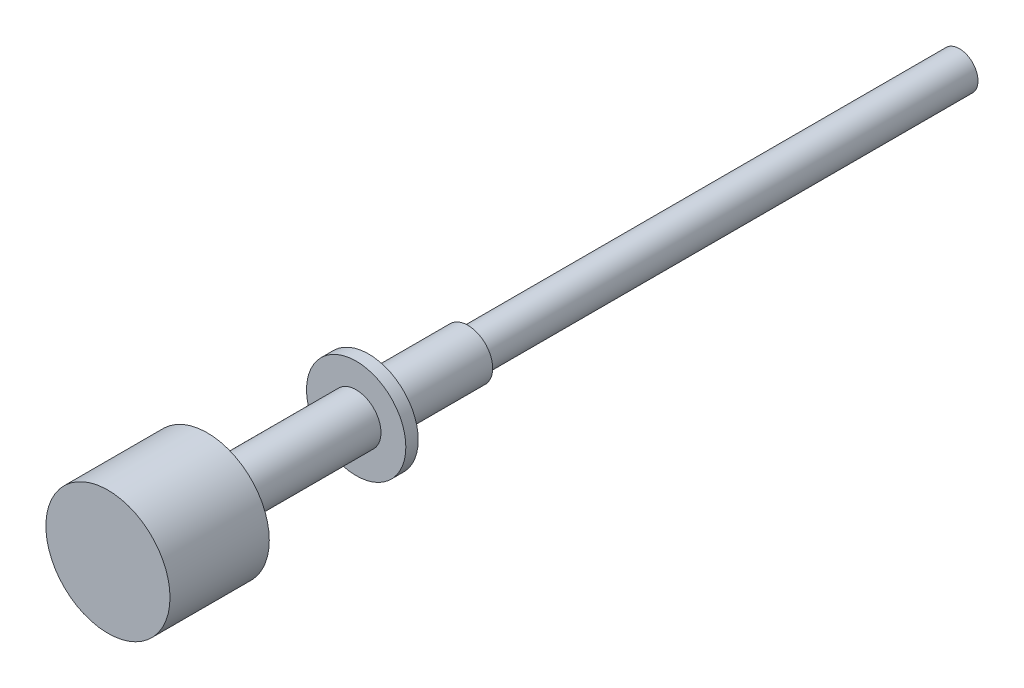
SolidWorks part; units mm, degrees
ref_plane "Front Plane" through (0, 0, 0) normal (0, 0, 1) x (1, 0, 0)
ref_plane "Top Plane" through (0, 0, 0) normal (0, 1, 0) x (1, 0, 0)
ref_plane "Right Plane" through (0, 0, 0) normal (1, 0, 0) x (0, 0, -1)
sketch "Sketch2" plane through (0, 0, 0) normal (0, 0, 1) x (1, 0, 0)
  circle A0 centre (0, 0) radius 4.7625
extrude "Boss-Extrude2" add sketch "Sketch2" along normal blind 125.73
sketch "Sketch3" plane through (0, 0, 125.73) normal (0, 0, 1) x (1, 0, 0)
  circle A0 centre (0, 0) radius 6.35
extrude "Boss-Extrude3" add sketch "Sketch3" along normal blind 25.4
sketch "Sketch4" plane through (0, 0, 151.13) normal (0, 0, 1) x (1, 0, 0)
  circle A0 centre (0, 0) radius 12.7
extrude "Boss-Extrude4" add sketch "Sketch4" along normal blind 3.175
sketch "Sketch5" plane through (0, 0, 154.305) normal (0, 0, 1) x (1, 0, 0)
  circle A0 centre (0, 0) radius 6.35
extrude "Boss-Extrude5" add sketch "Sketch5" along normal blind 38.1
sketch "Sketch6" plane through (0, 0, 192.405) normal (0, 0, 1) x (1, 0, 0)
  circle A0 centre (0, 0) radius 15.875
extrude "Boss-Extrude6" add sketch "Sketch6" along normal blind 25.4
